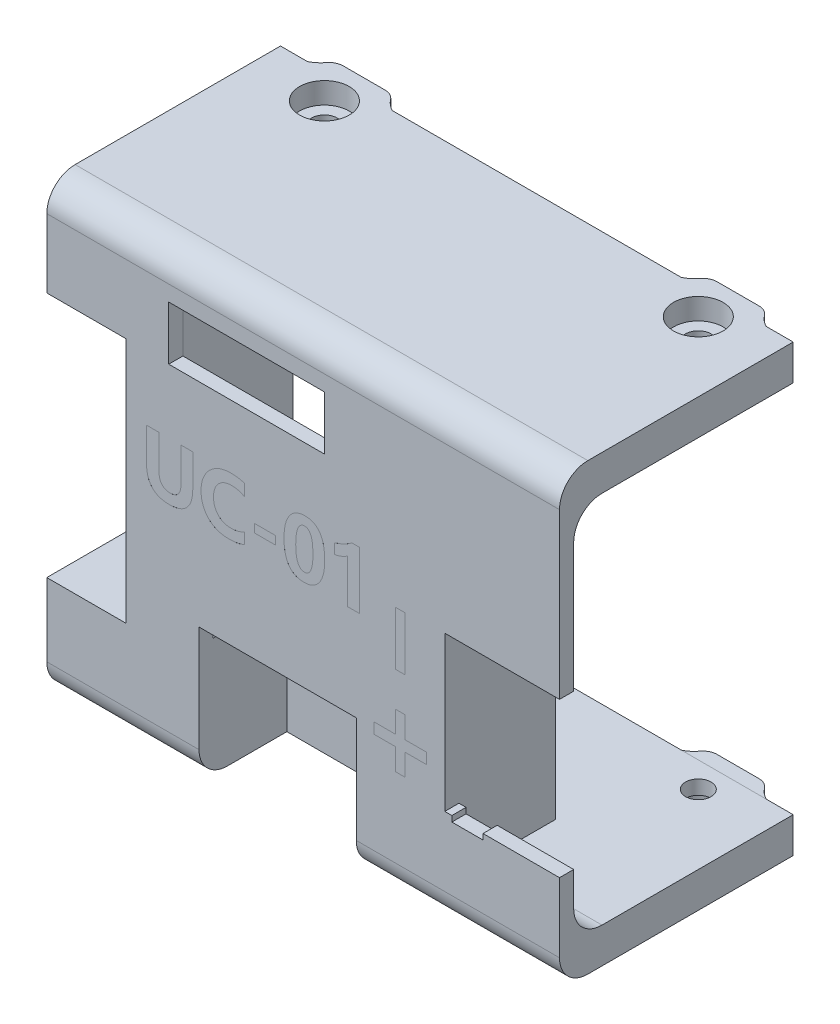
SolidWorks part; units mm, degrees
ref_plane "前视基准面" through (0, 0, 0) normal (0, 0, 1) x (1, 0, 0)
ref_plane "上视基准面" through (0, 0, 0) normal (0, 1, 0) x (1, 0, 0)
ref_plane "右视基准面" through (0, 0, 0) normal (1, 0, 0) x (0, 0, -1)
sketch "草图1" plane through (0, 0, 0) normal (0, 0, 1) x (1, 0, 0)
  line L0 (-17.8, 8.85) -> (-12.8, 8.85)
  line L2 (-12.8, 8.85) -> (-12.8, 0.35)
  line L3 (-12.8, 0.35) -> (-5.9, 0.35)
  line L4 (-5.9, 0.35) -> (-5.9, -6.45)
  line L5 (-5.9, -6.45) -> (-12.8, -6.45)
  line L6 (-12.8, -6.45) -> (-12.8, -8.55)
  line L7 (-12.8, -8.55) -> (-17.8, -8.55)
  line L8 (-17.8, -8.55) -> (-17.8, -14.2)
  line L9 (-17.8, -14.2) -> (17.8, -14.2)
  line L10 (17.8, -14.2) -> (17.8, -8.8)
  line L11 (17.8, -8.8) -> (12.4, -8.8)
  line L12 (9.7, -8.8) -> (9.7, 2.1)
  line L13 (9.7, 2.1) -> (17.8, 2.1)
  line L14 (17.8, 2.1) -> (17.8, 14.2013)
  line L15 (17.8, 14.2013) -> (-17.8, 14.2)
  line L16 (-17.8, 14.2) -> (-17.8, 8.85)
  line L31 (-9.7903, 12.6005) -> (1.2097, 12.6005)
  line L32 (-9.7903, 12.6005) -> (-9.7903, 8.8005)
  line L33 (-9.7903, 8.8005) -> (1.2097, 8.8005)
  line L34 (1.2097, 12.6005) -> (1.2097, 8.8005)
  line L35 (-6.35, -7.9) -> (2.25, -7.9) construction
  line L36 (-6.35, -7.9) -> (-6.35, -11.4) construction
  line L37 (-6.35, -11.4) -> (2.25, -11.4) construction
  line L38 (2.25, -7.9) -> (2.25, -11.4) construction
  line L42 (10.2, -8.8) -> (10.2, -9.2)
  line L43 (10.2, -9.2) -> (12.4, -9.2)
  line L44 (12.4, -9.2) -> (12.4, -8.8)
  line L45 (10.2, -8.8) -> (9.7, -8.8)
  point P0 (1.2097, 10.7005)
  dimension "D1" = 11
  dimension "D3" = 3.8
  dimension "D4" = 3.5
  dimension "D5" = 2.8
  dimension "D20" = 0.4
  dimension "D21" = 5.4
  dimension "D22" = 0.5
extrude "凸台-拉伸1" add sketch "草图1" against normal blind 1
sketch "草图2" plane through (0, 0, -1) normal (0, 0, -1) x (-1, 0, 0)
  line L0 (-17.8, -14.2) -> (-17.8, -8.8) construction
  line L1 (17.8, -14.2) -> (-17.8, -14.2)
  line L2 (17.8, -14.2) -> (17.8, -13.2)
  line L3 (17.8, -13.2) -> (-17.8, -13.2)
  line L4 (-17.8, -14.2) -> (-17.8, -13.2)
  line L6 (17.8, 13.2013) -> (-17.8, 13.2013)
  line L7 (17.8, 13.2013) -> (17.8, 14.2013)
  line L8 (17.8, 14.2013) -> (-17.8, 14.2013)
  line L9 (-17.8, 13.2013) -> (-17.8, 14.2013)
  line L12 (17.8, 14.2) -> (17.8, 8.85) construction
  dimension "D1" = 1
  dimension "D2" = 1
extrude "凸台-拉伸2" add sketch "草图2" along normal blind 15.5
fillet "圆角1" radius 2 2 edges at (0, -13.2, -1) (0, 13.2013, -1)
sketch "草图3" plane through (0, 14.2013, 0) normal (0, 1, 0) x (1, 0, 0)
  line L0 (-17.8, 16.5) -> (17.8, 16.5) construction
  line L3 (-13.5, 14.7) -> (12.9, 14.7) construction
  line L4 (-0.3, 14.7) -> (-0.3, 0) construction
  circle A1 centre (-13.5, 14.7) radius 0.9
  circle A3 centre (12.9, 14.7) radius 0.9
  dimension "D1" = 1.8
  dimension "D2" = 1.8
  dimension "D3" = 26.4
  dimension "D4" = 1.8
  dimension "D5" = 0.3
extrude "切除-拉伸1" cut sketch "草图3" against normal through all
sketch "草图4" plane through (17.8, 0, 0) normal (1, 0, 0) x (0, 0, -1)
  line L0 (2, 14.2013) -> (16.5, 14.2013)
  line L1 (0, 2.1) -> (0, -8.8)
  line L2 (1, 2.1) -> (1, -8.8)
  line L6 (0, -8.8) -> (0, -14.2)
  line L7 (0, -14.2) -> (16.5, -14.2)
  line L8 (16.5, -14.2) -> (16.5, -13.2)
  line L9 (16.5, -13.2) -> (3, -13.2)
  line L10 (1, -11.2) -> (1, -8.8)
  line L11 (1, -8.8) -> (0, -8.8)
  line L12 (0, -8.8) -> (0, -12.2)
  line L13 (2, -14.2) -> (16.5, -14.2)
  line L14 (16.5, -14.2) -> (16.5, -13.2)
  line L15 (16.5, -13.2) -> (3, -13.2)
  line L16 (1, -11.2) -> (1, -8.8)
  line L19 (0, 14.2013) -> (0, 2.1)
  line L20 (0, 2.1) -> (1, 2.1)
  line L21 (1, 2.1) -> (1, 11.2013)
  line L22 (3, 13.2013) -> (16.5, 13.2013)
  line L23 (16.5, 13.2013) -> (16.5, 14.2013)
  line L24 (16.5, 14.2013) -> (1, 14.2013)
  line L26 (0, 12.2013) -> (0, 2.1)
  line L28 (1, 2.1) -> (1, 11.2013)
  line L29 (3, 13.2013) -> (16.5, 13.2013)
  line L30 (16.5, 13.2013) -> (16.5, 14.2013)
  line L36 (1, 14.2013) -> (0, 14.2013)
  arc A0 (0, -12.2) -> (2, -14.2) centre (2, -12.2) ccw
  arc A1 (1, -11.2) -> (3, -13.2) centre (3, -11.2) ccw
  arc A2 (1, -11.2) -> (3, -13.2) centre (3, -11.2) ccw
  arc A3 (3, 13.2013) -> (1, 11.2013) centre (3, 11.2013) ccw
  arc A4 (3, 13.2013) -> (1, 11.2013) centre (3, 11.2013) ccw
  arc A5 (0, 12.2013) -> (2, 14.2013) centre (2, 12.2013) cw
  dimension "D3" = 2
  dimension "D1" = 0
  dimension "D2" = 0
extrude "切除-拉伸2" cut sketch "草图4" against normal through all flip side to cut
other "删除面1"
sketch "草图6" plane through (-17.8, 0, 0) normal (-1, 0, 0) x (0, 0, 1)
  line L0 (-16.5, 13.2013) -> (-3, 13.2013) construction
  line L1 (-16.5, -13.2) -> (-3, -13.2) construction
  line L2 (-1, -8.55) -> (-1, -11.2) construction
  line L3 (-1, 11.2013) -> (-1, 8.85) construction
  line L4 (-10.2, 13.2013) -> (-3, 13.2013)
  line L5 (-10.2, -13.2) -> (-3, -13.2)
  line L6 (-1, -8.55) -> (-1, -11.2)
  line L7 (-1, 11.2013) -> (-1, 8.85)
  line L8 (-1, 8.85) -> (-10.2, 8.85)
  line L9 (-10.2, 12.0027) -> (-10.2, -11.9987) construction
  line L10 (-10.2, 8.85) -> (-10.2, 13.2013)
  line L11 (-1, -8.55) -> (-10.2, -8.55)
  line L12 (-10.2, -8.55) -> (-10.2, -13.2)
  arc A0 (-3, -13.2) -> (-1, -11.2) centre (-3, -11.2) ccw construction
  arc A1 (-1, 11.2013) -> (-3, 13.2013) centre (-3, 11.2013) ccw construction
  arc A2 (-3, -13.2) -> (-1, -11.2) centre (-3, -11.2) ccw
  arc A3 (-1, 11.2013) -> (-3, 13.2013) centre (-3, 11.2013) ccw
extrude "凸台-拉伸3" add sketch "草图6" against normal blind 8
sketch "草图7" plane through (0, 0, -1) normal (0, 0, -1) x (-1, 0, 0)
  line L0 (9.8, 8.85) -> (12.8, 8.85) construction
  line L1 (12.8, 8.85) -> (9.8, 8.85)
  line L2 (12.8, 8.85) -> (12.8, 0.85)
  line L3 (12.8, 0.85) -> (9.8, 0.85)
  line L4 (9.8, 8.85) -> (9.8, 0.85)
  line L5 (12.8, -8.55) -> (9.8, -8.55)
  line L6 (12.8, -8.55) -> (12.8, -6.55)
  line L7 (12.8, -6.55) -> (9.8, -6.55)
  line L8 (9.8, -8.55) -> (9.8, -6.55)
  line L9 (9.8, -11.2) -> (9.8, -8.55) construction
  dimension "D1" = 8
  dimension "D2" = 2
extrude "凸台-拉伸4" add sketch "草图7" along normal blind 7.8
sketch "草图9" plane through (9.7, 0, 0) normal (1, 0, 0) x (0, 0, -1)
  line L1 (1, 11.2013) -> (1, -11.2)
  line L2 (3, -13.2) -> (8.8, -13.2)
  line L4 (8.8, -13.2) -> (8.8, 13.2013)
  line L5 (16.5, 13.2013) -> (3, 13.2013) construction
  line L6 (8.8, 13.2013) -> (3, 13.2013)
  line L7 (16.5, -13.2) -> (3, -13.2) construction
  arc A0 (3, 13.2013) -> (1, 11.2013) centre (3, 11.2013) ccw construction
  arc A1 (1, -11.2) -> (3, -13.2) centre (3, -11.2) ccw construction
  arc A2 (3, 13.2013) -> (1, 11.2013) centre (3, 11.2013) ccw
  arc A3 (1, -11.2) -> (3, -13.2) centre (3, -11.2) ccw
  dimension "D1" = 7.8
extrude "凸台-拉伸6" add sketch "草图9" against normal blind 6 contours L4 L6 A2 L1 A3 L2
other "移动面1" [suppressed] parameters "D1"=5
sketch "草图10" plane through (0, 0, 0) normal (0, 0, 1) x (1, 0, 0)
  line L0 (-12.8, 8.85) -> (-12.8, 10.85)
  line L2 (-12.8, 10.85) -> (-15.3, 10.85)
  line L3 (-15.3, 10.85) -> (-15.3, 8.85)
  line L4 (-17.8, 8.85) -> (-12.8, 8.85) construction
  dimension "D1" = 2.5
  dimension "D2" = 2
extrude "切除-拉伸3" cut sketch "草图10" against normal through all and the other way through all
sketch "草图11" plane through (0, 0, 0) normal (0, 0, 1) x (1, 0, 0)
  line L0 (-15.3, -8.55) -> (-15.3, -10.55)
  line L2 (-15.3, -10.55) -> (-12.8, -10.55)
  line L3 (-12.8, -10.55) -> (-12.8, -8.55)
  line L5 (-12.8, -8.55) -> (-17.8, -8.55) construction
  dimension "D1" = 2.5
  dimension "D2" = 2
extrude "切除-拉伸4" cut sketch "草图11" against normal through all and the other way through all
other "移动面2" parameters "D1"=0.6
other "移动面3" parameters "D1"=4.65
other "移动面5" parameters "D1"=4.35
sketch "草图13" plane through (0, 0, -8.8) normal (0, 0, -1) x (-1, 0, 0)
  line L0 (-3.7, -13.2) -> (-3.7, 13.2013) construction
  line L1 (-9.7, 13.2013) -> (-3.7, 13.2013)
  line L2 (-9.7, 13.2013) -> (-9.7, 0.0007)
  line L3 (-9.7, 0.0007) -> (-3.7, 0.0007)
  line L4 (-3.7, 13.2013) -> (-3.7, 0.0007)
extrude "切除-拉伸5" cut sketch "草图13" against normal blind 1
sketch "草图14" plane through (0, 0, 0) normal (0, 0, 1) x (1, 0, 0)
  line L0 (-12.8, 10.85) -> (-12.8, -10.55) construction
  line L1 (-15.3, 10.85) -> (-12.8, 10.85)
  line L2 (-15.3, 10.85) -> (-15.3, 8.85)
  line L3 (-15.3, 8.85) -> (-12.8, 8.85)
  line L4 (-12.8, 10.85) -> (-12.8, 8.85)
  line L6 (-15.3, -8.55) -> (-12.8, -8.55)
  line L7 (-15.3, -8.55) -> (-15.3, -10.55)
  line L8 (-15.3, -10.55) -> (-12.8, -10.55)
  line L9 (-12.8, -8.55) -> (-12.8, -10.55)
extrude "凸台-拉伸7" add sketch "草图14" against normal up to surface (8.8 mm away)
sketch "草图16" plane through (0, 0, 0) normal (0, 0, 1) x (1, 0, 0)
  line L0 (17.7, -11.9987) -> (-18.3, -11.9987) construction
  line L1 (-7.6499, -8.1987) -> (3.3501, -8.1987)
  line L2 (-7.6499, -8.1987) -> (-7.6499, -11.9987)
  line L3 (-7.6499, -11.9987) -> (3.3501, -11.9987)
  line L4 (3.3501, -8.1987) -> (3.3501, -11.9987)
  line L5 (-7.6499, -8.1987) -> (3.3501, -11.9987) construction
  line L6 (-7.6499, -11.9987) -> (3.3501, -8.1987) construction
  line L7 (-2.1499, -9.7947) -> (-2.1499, -10.3027) construction
  point P4 (-2.1499, -10.0987)
  dimension "D1" = 11
  dimension "D2" = 3.8
extrude "切除-拉伸7" cut sketch "草图16" against normal blind 10
sketch "草图17" plane through (0, -14.2, 0) normal (0, -1, 0) x (1, 0, 0)
  line L1 (-7.6499, 0) -> (3.3501, 0)
  line L2 (-7.6499, 0) -> (-7.6499, -6.2)
  line L3 (-7.6499, -6.2) -> (3.3501, -6.2)
  line L4 (3.3501, 0) -> (3.3501, -6.2)
  line L5 (-7.6499, 0) -> (3.3501, -6.2) construction
  line L6 (-7.6499, -6.2) -> (3.3501, 0) construction
  line L7 (3.3501, -1.1664) -> (3.3501, 0) construction
  line L8 (-18.4, 0) -> (17.8, 0) construction
  point P4 (-2.1499, -3.1)
  dimension "D1" = 6.2
extrude "切除-拉伸8" cut sketch "草图17" against normal up to surface (6.0013 mm away)
sketch "草图18" plane through (0, 0, -1) normal (0, 0, -1) x (-1, 0, 0)
  line L0 (-3.7, 11.2013) -> (-3.7, -11.2) construction
  line L1 (-3.7, -8.1987) -> (5.5675, -8.1987)
  line L2 (-3.7, -8.1987) -> (-3.7, -5.1987)
  line L3 (-3.7, -5.1987) -> (5.5675, -5.1987)
  line L4 (5.5675, -7.3751) -> (5.5675, -5.1987)
  line L5 (-3.7, -8.1987) -> (5.5675, -5.1987) construction
  line L6 (-3.7, -5.1987) -> (5.5675, -8.1987) construction
  line L8 (-3.3501, -8.1987) -> (7.6499, -8.1987) construction
  line L9 (5.5675, -7.3751) -> (9.8, -7.3751)
  line L10 (9.8, -7.3751) -> (9.8, -13.2)
  line L12 (9.8, -13.2) -> (7.6499, -13.2)
  line L13 (7.6499, -13.2) -> (7.6499, -8.1987)
  line L16 (7.6499, -8.1987) -> (5.5675, -8.1987)
  line L17 (9.8, -6.55) -> (9.8, -13.2) construction
  line L19 (9.8, -13.2) -> (7.6499, -13.2) construction
  point P4 (0.9337, -6.6987)
  dimension "D1" = 3
extrude "凸台-拉伸8" add sketch "草图18" along normal up to surface (7.8 mm away)
other "移动面6" parameters "D1"=0.25
sketch "草图20" plane through (0, -14.2, 0) normal (0, -1, 0) x (1, 0, 0)
  line L1 (-7.6499, -6.2) -> (3.7, -6.2)
  line L2 (-7.6499, -6.2) -> (-7.6499, -8.8)
  line L3 (-7.6499, -8.8) -> (3.7, -8.8)
  line L4 (3.7, -6.2) -> (3.7, -8.8)
  line L5 (-7.6499, -6.2) -> (3.7, -8.8) construction
  line L6 (-7.6499, -8.8) -> (3.7, -6.2) construction
  point P4 (-1.9749, -7.5)
extrude "凸台-拉伸9" add sketch "草图20" against normal blind 2.5
other "删除面2"
other "移动面8" parameters "D1"=1.5
sketch "草图21" plane through (0, -15.7, 0) normal (0, -1, 0) x (1, 0, 0)
  circle A0 centre (-13.5, -14.7) radius 1.75
  circle A1 centre (12.9, -14.7) radius 1.75
  dimension "D1" = 3.5
extrude "切除-拉伸9" cut sketch "草图21" against normal blind 1.5
sketch "草图22" plane through (0, 15.7013, 0) normal (0, 1, 0) x (1, 0, 0)
  circle A0 centre (-13.5, 14.7) radius 1.75
  circle A1 centre (12.9, 14.7) radius 1.75
  dimension "D1" = 3.5
extrude "切除-拉伸10" cut sketch "草图22" against normal blind 1.5
fillet "圆角2" radius 2 3 edges at (10.5751, -15.7, 0) (-0.3, 15.7013, 0) (-13.0249, -15.7, 0)
sketch "草图23" plane through (0, 0, 0) normal (0, 0, 1) x (1, 0, 0)
  line L0 (-12.8, 8.85) -> (-12.8, -8.55) construction
  text T0 "UC-01" font "微软雅黑" height 4
  dimension "D1" = 1
extrude "切除-拉伸11" cut sketch "草图23" against normal blind 0.2
sketch "草图24" plane through (0, 0, -0.2) normal (0, 0, 1) x (1, 0, 0)
  line L5 (-2.239, 1.5082) -> (-2.239, 2.0935) construction
  line L6 (-2.239, 2.0935) -> (-3.7512, 2.0935) construction
  line L7 (-3.7512, 2.0935) -> (-3.7512, 1.5082) construction
  line L8 (-3.7512, 1.5082) -> (-2.239, 1.5082) construction
  line L9 (-4.4341, 0.4495) -> (-4.4341, 1.2155) construction
  line L10 (-4.4341, 3.3618) -> (-4.4341, 4.185) construction
  line L11 (-8.0927, 2.0203) -> (-8.0927, 4.2886) construction
  line L12 (-8.0927, 4.2886) -> (-8.922, 4.2886) construction
  line L13 (-8.922, 4.2886) -> (-8.922, 1.9304) construction
  line L14 (-10.4829, 1.967) -> (-10.4829, 4.2886) construction
  line L15 (-10.4829, 4.2886) -> (-11.361, 4.2886) construction
  line L16 (-11.361, 4.2886) -> (-11.361, 1.9739) construction
  line L22 (-2.239, 1.5082) -> (-2.239, 2.0935)
  line L23 (-2.239, 2.0935) -> (-3.7512, 2.0935)
  line L24 (-3.7512, 2.0935) -> (-3.7512, 1.5082)
  line L25 (-3.7512, 1.5082) -> (-2.239, 1.5082)
  line L26 (-4.4341, 0.4495) -> (-4.4341, 1.2155)
  line L27 (-4.4341, 3.3618) -> (-4.4341, 4.185)
  line L28 (-8.0927, 2.0203) -> (-8.0927, 4.2886)
  line L29 (-8.0927, 4.2886) -> (-8.922, 4.2886)
  line L30 (-8.922, 4.2886) -> (-8.922, 1.9304)
  line L31 (-10.4829, 1.967) -> (-10.4829, 4.2886)
  line L32 (-10.4829, 4.2886) -> (-11.361, 4.2886)
  line L33 (-11.361, 4.2886) -> (-11.361, 1.9739)
  line L39 (3.6634, 4.3374) -> (3.1405, 4.3374)
  line L40 (1.9073, 3.733) -> (1.9073, 3.0203)
  line L41 (2.8341, 3.3931) -> (2.8341, 0.2886)
  line L42 (2.8341, 0.2886) -> (3.6634, 0.2886)
  line L43 (3.6634, 0.2886) -> (3.6634, 4.3374)
  line L44 (3.6634, 4.3374) -> (3.1405, 4.3374)
  line L45 (1.9073, 3.733) -> (1.9073, 3.0203)
  line L46 (2.8341, 3.3931) -> (2.8341, 0.2886)
  line L47 (2.8341, 0.2886) -> (3.6634, 0.2886)
  line L48 (3.6634, 0.2886) -> (3.6634, 4.3374)
  spline S3 degree 3 poles (447.3482, -890.9115) (-3.7031, 15.2341) (-1.3723, 2.5269) (-4.6578, 1.1076) (-4.7746, 1.0655) (-4.8945, 1.0311) (-5.0173, 1.0045) (-5.143, 0.9854) (-8.9746, 0.6371) (-13.3163, 12.608) (28.2486, -998.4467) knots -10.258138 -10.258138 -10.258138 -10.258138 0.123289 0.246059 0.368848 0.492193 0.616624 0.741912 0.870046 12.042592 12.042592 12.042592 12.042592 only from (-4.4341, 1.2155) to (-5.4021, 0.9716) construction
  spline S4 degree 3 poles (-58.3829, -997.62) (2.0899, 14.5382) (-2.224, 0.5394) (-5.6685, 0.9915) (-5.7921, 1.0193) (-5.9084, 1.0588) (-6.0178, 1.1077) (-6.1193, 1.1696) (-6.2134, 1.2425) (-6.3001, 1.3254) (-6.3779, 1.4176) (-6.4452, 1.5179) (-6.502, 1.6255) (-6.5482, 1.74) (-6.5853, 1.8613) (-6.6108, 1.9897) (-7.0383, 5.7463) (6.2612, 10.2353) (-1005.5774, -43.2789) knots -4.971116 -4.971116 -4.971116 -4.971116 0.068212 0.133499 0.196423 0.256776 0.316257 0.374705 0.433557 0.493283 0.55321 0.612969 0.672933 0.734251 0.796781 0.861688 0.929139 6.423769 6.423769 6.423769 6.423769 only from (-5.4021, 0.9716) to (-6.6293, 2.2658) construction
  spline S5 degree 3 poles (-1005.0194, 58.9049) (7.2315, -5.5986) (-7.0712, -1.0508) (-6.6088, 2.5493) (-6.5834, 2.6819) (-6.5435, 2.8065) (-6.4952, 2.925) (-6.4344, 3.0358) (-6.3634, 3.14) (-6.2818, 3.2359) (-6.1914, 3.3228) (-6.0925, 3.3987) (-5.9863, 3.4631) (-5.8724, 3.5148) (-5.7519, 3.5567) (-5.6235, 3.5852) (-1.9471, 4.0411) (2.5575, -9.464) (-57.0147, 1002.2588) knots -5.005182 -5.005182 -5.005182 -5.005182 0.070115 0.137017 0.20143 0.263758 0.324619 0.384879 0.445005 0.50533 0.565469 0.624812 0.684081 0.74352 0.80411 0.866968 0.932059 6.116477 6.116477 6.116477 6.116477 only from (-6.6293, 2.2658) to (-5.348, 3.6057) construction
  spline S6 degree 3 poles (31.8274, 1002.913) (-12.9494, -8.1188) (-8.7481, 3.9419) (-5.1001, 3.5918) (-4.9804, 3.5729) (-4.8642, 3.5463) (-4.7515, 3.5116) (-4.6419, 3.4698) (-1.6184, 2.0699) (-4.6337, -10.5677) (474.6811, 881.1006) knots -11.08115 -11.08115 -11.08115 -11.08115 0.131365 0.260042 0.386555 0.51068 0.633019 0.755687 0.877798 11.054687 11.054687 11.054687 11.054687 only from (-5.348, 3.6057) to (-4.4341, 3.3618) construction
  spline S7 degree 3 poles (327.0674, 947.639) (-1.7117, -8.2725) (-1.351, 3.2979) (-4.6427, 4.2535) (-4.7555, 4.2791) (-4.8743, 4.3006) (-4.9989, 4.317) (-5.1293, 4.3294) (-10.0457, 4.5726) (-15.1405, -5.5057) (1.7412, 1004.308) knots -10.047872 -10.047872 -10.047872 -10.047872 0.107963 0.220366 0.337373 0.458737 0.586233 0.718567 0.855895 15.509195 15.509195 15.509195 15.509195 only from (-4.4341, 4.185) to (-5.4059, 4.3374) construction
  spline S8 degree 3 poles (-57.6899, 1002.9688) (4.8826, -11.7097) (-1.0209, 4.9509) (-5.8467, 4.3035) (-6.0532, 4.2577) (-6.2486, 4.1914) (-6.4341, 4.1079) (-6.608, 4.0037) (-6.7721, 3.8824) (-6.9228, 3.7421) (-7.0597, 3.5879) (-7.1799, 3.4223) (-7.2815, 3.2455) (-7.3636, 3.0577) (-7.4291, 2.8596) (-7.4742, 2.6503) (-8.1108, -2.3067) (8.3132, -8.2822) (-1006.272, 51.6656) knots -4.141639 -4.141639 -4.141639 -4.141639 0.067389 0.13232 0.194855 0.255866 0.316133 0.376011 0.436454 0.4979 0.55941 0.620133 0.680255 0.740957 0.802757 0.866128 0.931705 5.254621 5.254621 5.254621 5.254621 only from (-5.4059, 4.3374) to (-7.5073, 2.204) construction
  spline S9 degree 3 poles (-1006.6116, -40.0715) (7.5102, 12.5009) (-8.0628, 6.7177) (-7.478, 1.7826) (-7.4368, 1.5864) (-7.3799, 1.4011) (-7.3058, 1.227) (-7.2143, 1.0645) (-7.1073, 0.9129) (-6.9845, 0.7733) (-6.8475, 0.6478) (-6.6982, 0.5376) (-6.5361, 0.4464) (-6.3636, 0.3701) (-6.1792, 0.3118) (-5.9834, 0.2699) (-1.1365, -0.3279) (4.6206, 15.6065) (-50.5508, -998.7248) knots -4.566138 -4.566138 -4.566138 -4.566138 0.069616 0.136223 0.200084 0.261924 0.322179 0.381519 0.440709 0.500203 0.559804 0.618828 0.678076 0.738077 0.799831 0.863504 0.93014 5.483125 5.483125 5.483125 5.483125 only from (-7.5073, 2.204) to (-5.5614, 0.2399) construction
  spline S10 degree 3 poles (8.5748, -999.6594) (-15.6172, 11.7428) (-10.2761, -0.0632) (-5.2329, 0.2514) (-5.0795, 0.2681) (-4.9342, 0.2908) (-4.7968, 0.3193) (-4.6682, 0.3563) (-1.3965, 1.4907) (-3.0171, 14.5127) (382.1615, -921.7816) knots -12.687678 -12.687678 -12.687678 -12.687678 0.147062 0.286452 0.419776 0.547259 0.667915 0.783756 0.894285 9.644628 9.644628 9.644628 9.644628 only from (-5.5614, 0.2399) to (-4.4341, 0.4495) construction
  spline S11 degree 3 poles (990.6881, -25.9645) (-19.9383, 9.2654) (-8.6331, 5.2812) (-8.9327, 1.7077) (-8.948, 1.6064) (-8.9681, 1.5124) (-8.9957, 1.426) (-9.029, 1.3468) (-9.0678, 1.2747) (-9.1142, 1.2114) (-9.1652, 1.154) (-9.2236, 1.1054) (-9.2874, 1.0636) (-9.3578, 1.03) (-9.4338, 1.0031) (-9.5163, 0.9855) (-12.1393, 0.629) (-15.6353, 13.0838) (52.8097, -997.0511) knots -7.393918 -7.393918 -7.393918 -7.393918 0.082236 0.159849 0.232589 0.300169 0.36431 0.425385 0.48275 0.53814 0.59213 0.645867 0.699421 0.754089 0.81139 0.870698 0.933422 6.436963 6.436963 6.436963 6.436963 only from (-8.922, 1.9304) to (-9.6963, 0.9716) construction
  spline S12 degree 3 poles (-60.1304, -997.7553) (-3.708, 12.7839) (-7.145, 0.6379) (-9.8796, 0.985) (-9.9629, 1.0047) (-10.0401, 1.0324) (-10.1113, 1.0675) (-10.1766, 1.1102) (-10.2353, 1.1615) (-10.2878, 1.2201) (-10.334, 1.2868) (-10.3745, 1.3608) (-10.408, 1.4432) (-10.4348, 1.5332) (-10.4575, 1.6306) (-10.472, 1.7359) (-10.7759, 5.396) (0.7037, 9.5294) (-1009.9473, -30.5076) knots -5.506458 -5.506458 -5.506458 -5.506458 0.065783 0.127811 0.186736 0.242624 0.297183 0.350708 0.403639 0.458007 0.513148 0.571273 0.63211 0.696983 0.765484 0.838809 0.91689 8.36214 8.36214 8.36214 8.36214 only from (-9.6963, 0.9716) to (-10.4829, 1.967) construction
  spline S13 degree 3 poles (-1010.7633, -32.5066) (2.9776, 12.2638) (-11.8358, 6.5734) (-11.3384, 1.5713) (-11.308, 1.3876) (-11.2636, 1.2175) (-11.2077, 1.0608) (-11.1387, 0.9175) (-11.0571, 0.7877) (-10.9617, 0.6719) (-10.8547, 0.5689) (-10.7342, 0.4806) (-10.6017, 0.4057) (-10.4564, 0.3445) (-10.2986, 0.2975) (-10.1283, 0.2645) (-5.5741, -0.2614) (-0.1904, 14.8104) (-53.3661, -998.8082) knots -5.339301 -5.339301 -5.339301 -5.339301 0.077366 0.150259 0.218727 0.283252 0.344541 0.402648 0.458898 0.513844 0.568341 0.622841 0.678755 0.736469 0.796966 0.860609 0.928246 5.863965 5.863965 5.863965 5.863965 only from (-11.361, 1.9739) to (-9.755, 0.2399) construction
  spline S14 degree 3 poles (36.0873, -998.707) (-19.4521, 15.2136) (-13.9656, -0.2759) (-9.3688, 0.2654) (-9.1925, 0.2986) (-9.0294, 0.3477) (-8.8786, 0.4099) (-8.7416, 0.4875) (-8.6166, 0.5778) (-8.5056, 0.6832) (-8.4069, 0.8021) (-8.3235, 0.936) (-8.2512, 1.0826) (-8.1926, 1.2434) (-8.1483, 1.4185) (-8.1155, 1.6067) (-7.6201, 6.9397) (-21.8649, 12.842) (991.5286, -25.4517) knots -4.759628 -4.759628 -4.759628 -4.759628 0.072067 0.139886 0.203826 0.264504 0.322468 0.378541 0.43322 0.487644 0.542487 0.598649 0.656728 0.71775 0.782003 0.850404 0.922752 6.526676 6.526676 6.526676 6.526676 only from (-9.755, 0.2399) to (-8.0927, 2.0203) construction
  spline S17 degree 3 poles (1177.1826, -1614.7304) (2.6721, 26.1054) (8.1484, 7.6131) (2.8687, 4.1488) (2.7228, 4.0656) (2.5716, 3.9868) (2.4147, 3.9133) (2.251, 3.8475) (-3.9719, 1.5791) (-16.3139, 18.0778) (609.1367, -1901.742) knots -13.347297 -13.347297 -13.347297 -13.347297 0.11901 0.23902 0.360663 0.483838 0.609267 0.736759 0.866991 14.991437 14.991437 14.991437 14.991437 only from (3.1405, 4.3374) to (1.9073, 3.733)
  spline S18 degree 3 poles (-4.4341, 1.2155) (-4.4707, 1.1959) (-4.5437, 1.1568) (-4.6578, 1.1076) (-4.7746, 1.0655) (-4.8945, 1.0311) (-5.0173, 1.0045) (-5.143, 0.9854) (-5.2716, 0.9737) (-5.3584, 0.9723) (-5.4021, 0.9716) knots 0 0 0 0 0.123289 0.246059 0.368848 0.492193 0.616624 0.741912 0.870046 1 1 1 1
  spline S19 degree 3 poles (-5.4021, 0.9716) (-5.4479, 0.9725) (-5.5375, 0.9743) (-5.6685, 0.9915) (-5.7921, 1.0193) (-5.9084, 1.0588) (-6.0178, 1.1077) (-6.1193, 1.1696) (-6.2134, 1.2425) (-6.3001, 1.3254) (-6.3779, 1.4176) (-6.4452, 1.5179) (-6.502, 1.6255) (-6.5482, 1.74) (-6.5853, 1.8613) (-6.6108, 1.9897) (-6.6262, 2.1254) (-6.6282, 2.2182) (-6.6293, 2.2658) knots 0 0 0 0 0.068212 0.133499 0.196423 0.256776 0.316257 0.374705 0.433557 0.493283 0.55321 0.612969 0.672933 0.734251 0.796781 0.861688 0.929139 1 1 1 1
  spline S20 degree 3 poles (-6.6293, 2.2658) (-6.6284, 2.3146) (-6.6267, 2.4101) (-6.6088, 2.5493) (-6.5834, 2.6819) (-6.5435, 2.8065) (-6.4952, 2.925) (-6.4344, 3.0358) (-6.3634, 3.14) (-6.2818, 3.2359) (-6.1914, 3.3228) (-6.0925, 3.3987) (-5.9863, 3.4631) (-5.8724, 3.5148) (-5.7519, 3.5567) (-5.6235, 3.5852) (-5.4879, 3.602) (-5.3953, 3.6045) (-5.348, 3.6057) knots 0 0 0 0 0.070115 0.137017 0.20143 0.263758 0.324619 0.384879 0.445005 0.50533 0.565469 0.624812 0.684081 0.74352 0.80411 0.866968 0.932059 1 1 1 1
  spline S21 degree 3 poles (-5.348, 3.6057) (-5.3061, 3.605) (-5.223, 3.6036) (-5.1001, 3.5918) (-4.9804, 3.5729) (-4.8642, 3.5463) (-4.7515, 3.5116) (-4.6419, 3.4698) (-4.5354, 3.4205) (-4.4679, 3.3814) (-4.4341, 3.3618) knots 0 0 0 0 0.131365 0.260042 0.386555 0.51068 0.633019 0.755687 0.877798 1 1 1 1
  spline S22 degree 3 poles (-4.4341, 4.185) (-4.4675, 4.1973) (-4.5357, 4.2225) (-4.6427, 4.2535) (-4.7555, 4.2791) (-4.8743, 4.3006) (-4.9989, 4.317) (-5.1293, 4.3294) (-5.2656, 4.3361) (-5.3584, 4.337) (-5.4059, 4.3374) knots 0 0 0 0 0.107963 0.220366 0.337373 0.458737 0.586233 0.718567 0.855895 1 1 1 1
  spline S23 degree 3 poles (-5.4059, 4.3374) (-5.4815, 4.3358) (-5.6298, 4.3326) (-5.8467, 4.3035) (-6.0532, 4.2577) (-6.2486, 4.1914) (-6.4341, 4.1079) (-6.608, 4.0037) (-6.7721, 3.8824) (-6.9228, 3.7421) (-7.0597, 3.5879) (-7.1799, 3.4223) (-7.2815, 3.2455) (-7.3636, 3.0577) (-7.4291, 2.8596) (-7.4742, 2.6503) (-7.5024, 2.4307) (-7.5056, 2.2806) (-7.5073, 2.204) knots 0 0 0 0 0.067389 0.13232 0.194855 0.255866 0.316133 0.376011 0.436454 0.4979 0.55941 0.620133 0.680255 0.740957 0.802757 0.866128 0.931705 1 1 1 1
  spline S24 degree 3 poles (-7.5073, 2.204) (-7.5057, 2.1316) (-7.5025, 1.9897) (-7.478, 1.7826) (-7.4368, 1.5864) (-7.3799, 1.4011) (-7.3058, 1.227) (-7.2143, 1.0645) (-7.1073, 0.9129) (-6.9845, 0.7733) (-6.8475, 0.6478) (-6.6982, 0.5376) (-6.5361, 0.4464) (-6.3636, 0.3701) (-6.1792, 0.3118) (-5.9834, 0.2699) (-5.7763, 0.2444) (-5.6342, 0.2414) (-5.5614, 0.2399) knots 0 0 0 0 0.069616 0.136223 0.200084 0.261924 0.322179 0.381519 0.440709 0.500203 0.559804 0.618828 0.678076 0.738077 0.799831 0.863504 0.93014 1 1 1 1
  spline S25 degree 3 poles (-5.5614, 0.2399) (-5.5048, 0.2404) (-5.3944, 0.2413) (-5.2329, 0.2514) (-5.0795, 0.2681) (-4.9342, 0.2908) (-4.7968, 0.3193) (-4.6682, 0.3563) (-4.5472, 0.3982) (-4.4713, 0.4326) (-4.4341, 0.4495) knots 0 0 0 0 0.147062 0.286452 0.419776 0.547259 0.667915 0.783756 0.894285 1 1 1 1
  spline S26 degree 3 poles (-8.922, 1.9304) (-8.9225, 1.8918) (-8.9236, 1.8167) (-8.9327, 1.7077) (-8.948, 1.6064) (-8.9681, 1.5124) (-8.9957, 1.426) (-9.029, 1.3468) (-9.0678, 1.2747) (-9.1142, 1.2114) (-9.1652, 1.154) (-9.2236, 1.1054) (-9.2874, 1.0636) (-9.3578, 1.03) (-9.4338, 1.0031) (-9.5163, 0.9855) (-9.6043, 0.9735) (-9.665, 0.9722) (-9.6963, 0.9716) knots 0 0 0 0 0.082236 0.159849 0.232589 0.300169 0.36431 0.425385 0.48275 0.53814 0.59213 0.645867 0.699421 0.754089 0.81139 0.870698 0.933422 1 1 1 1
  spline S27 degree 3 poles (-9.6963, 0.9716) (-9.7281, 0.9723) (-9.7899, 0.9736) (-9.8796, 0.985) (-9.9629, 1.0047) (-10.0401, 1.0324) (-10.1113, 1.0675) (-10.1766, 1.1102) (-10.2353, 1.1615) (-10.2878, 1.2201) (-10.334, 1.2868) (-10.3745, 1.3608) (-10.408, 1.4432) (-10.4348, 1.5332) (-10.4575, 1.6306) (-10.472, 1.7359) (-10.4813, 1.8489) (-10.4824, 1.9268) (-10.4829, 1.967) knots 0 0 0 0 0.065783 0.127811 0.186736 0.242624 0.297183 0.350708 0.403639 0.458007 0.513148 0.571273 0.63211 0.696983 0.765484 0.838809 0.91689 1 1 1 1
  spline S28 degree 3 poles (-11.361, 1.9739) (-11.36, 1.9039) (-11.358, 1.7681) (-11.3384, 1.5713) (-11.308, 1.3876) (-11.2636, 1.2175) (-11.2077, 1.0608) (-11.1387, 0.9175) (-11.0571, 0.7877) (-10.9617, 0.6719) (-10.8547, 0.5689) (-10.7342, 0.4806) (-10.6017, 0.4057) (-10.4564, 0.3445) (-10.2986, 0.2975) (-10.1283, 0.2645) (-9.9459, 0.2434) (-9.8199, 0.2411) (-9.755, 0.2399) knots 0 0 0 0 0.077366 0.150259 0.218727 0.283252 0.344541 0.402648 0.458898 0.513844 0.568341 0.622841 0.678755 0.736469 0.796966 0.860609 0.928246 1 1 1 1
  spline S29 degree 3 poles (-9.755, 0.2399) (-9.6879, 0.241) (-9.5576, 0.2432) (-9.3688, 0.2654) (-9.1925, 0.2986) (-9.0294, 0.3477) (-8.8786, 0.4099) (-8.7416, 0.4875) (-8.6166, 0.5778) (-8.5056, 0.6832) (-8.4069, 0.8021) (-8.3235, 0.936) (-8.2512, 1.0826) (-8.1926, 1.2434) (-8.1483, 1.4185) (-8.1155, 1.6067) (-8.0967, 1.8091) (-8.0941, 1.9484) (-8.0927, 2.0203) knots 0 0 0 0 0.072067 0.139886 0.203826 0.264504 0.322468 0.378541 0.43322 0.487644 0.542487 0.598649 0.656728 0.71775 0.782003 0.850404 0.922752 1 1 1 1
  spline S30 degree 3 poles (345.0808, -1967.2626) (-9.5696, 20.842) (-1.9523, 2.0887) (2.1487, 3.0663) (2.2762, 3.1046) (2.4059, 3.1518) (2.5319, 3.2047) (2.6463, 3.2635) (5.7336, 5.1244) (-3.6058, 24.4526) (1167.4311, -1622.4991) knots -12.13168 -12.13168 -12.13168 -12.13168 0.116848 0.240752 0.372278 0.511899 0.650498 0.777711 0.893917 11.331892 11.331892 11.331892 11.331892 only from (1.9073, 3.0203) to (2.8341, 3.3931)
  spline S31 degree 3 poles (-2000.7953, -52.1675) (20.3133, 17.4544) (-2.2049, 9.205) (-1.6338, 1.7642) (-1.6073, 1.5543) (-1.5683, 1.36) (-1.5194, 1.1808) (-1.4585, 1.0172) (-1.3869, 0.8688) (-1.3036, 0.7358) (-1.2088, 0.6187) (-1.1034, 0.5164) (-0.986, 0.4306) (-0.8575, 0.3609) (-0.7182, 0.3064) (-0.5679, 0.268) (4.1878, -0.4515) (10.7859, 24.6644) (-132.5936, -1995.2913) knots -7.822298 -7.822298 -7.822298 -7.822298 0.086578 0.167865 0.244075 0.315263 0.381998 0.444776 0.503765 0.559952 0.614067 0.666344 0.718446 0.770706 0.824131 0.879782 0.938113 6.012932 6.012932 6.012932 6.012932 only from (-1.6537, 2.2246) to (-0.2383, 0.2399)
  spline S32 degree 3 poles (131.3302, -1995.3425) (-11.311, 24.5676) (-4.6938, -0.4727) (0.0946, 0.2697) (0.2471, 0.3126) (0.389, 0.3726) (0.5215, 0.4479) (0.6423, 0.5425) (0.7522, 0.6537) (0.8517, 0.7812) (0.9398, 0.9239) (1.0161, 1.0814) (1.0808, 1.2529) (1.1339, 1.4385) (1.1749, 1.6383) (1.2031, 1.852) (1.7947, 9.3898) (-20.544, 17.7602) (2000.3662, -54.5295) knots -4.876629 -4.876629 -4.876629 -4.876629 0.060073 0.117299 0.171929 0.225233 0.277923 0.330711 0.384967 0.440945 0.49937 0.559927 0.623536 0.690675 0.761437 0.836458 0.915811 8.657474 8.657474 8.657474 8.657474 only from (-0.2383, 0.2399) to (1.2244, 2.3168)
  spline S33 degree 3 poles (2000.6666, 45.3728) (-19.918, -13.603) (1.7529, -5.0777) (1.2056, 2.7857) (1.1786, 2.9993) (1.1404, 3.197) (1.0935, 3.3796) (1.0327, 3.5455) (0.9632, 3.6966) (0.882, 3.8321) (0.7898, 3.9518) (0.6857, 4.055) (0.5715, 4.1428) (0.4457, 4.2142) (0.3094, 4.2699) (0.1622, 4.3095) (-4.5314, 5.0226) (-11.0019, -19.8525) (128.6121, 2000.1168) knots -8.247954 -8.247954 -8.247954 -8.247954 0.087973 0.170373 0.247723 0.319998 0.387454 0.450729 0.510302 0.566596 0.620689 0.672807 0.72421 0.775629 0.828343 0.88258 0.939659 5.933718 5.933718 5.933718 5.933718 only from (1.2244, 2.3168) to (-0.1605, 4.3374)
  spline S34 degree 3 poles (-129.3875, 2000.0838) (11.0603, -20.0947) (4.3758, 5.052) (-0.5004, 4.3075) (-0.6563, 4.2648) (-0.8016, 4.2051) (-0.9361, 4.1282) (-1.06, 4.0344) (-1.1725, 3.9228) (-1.2741, 3.7948) (-1.3639, 3.6509) (-1.4418, 3.4917) (-1.5081, 3.3177) (-1.561, 3.128) (-1.6024, 2.9237) (-1.633, 2.7041) (-2.2112, -5.2487) (19.609, -13.8563) (-2001.1154, 44.0574) knots -4.866609 -4.866609 -4.866609 -4.866609 0.060191 0.117319 0.172128 0.225344 0.277803 0.330379 0.38412 0.439685 0.497456 0.557518 0.621033 0.687852 0.759059 0.834479 0.914866 8.921272 8.921272 8.921272 8.921272 only from (-0.1605, 4.3374) to (-1.6537, 2.2246)
  spline S35 degree 3 poles (-1.6537, 2.2246) (-1.6528, 2.1445) (-1.6511, 1.9893) (-1.6338, 1.7642) (-1.6073, 1.5543) (-1.5683, 1.36) (-1.5194, 1.1808) (-1.4585, 1.0172) (-1.3869, 0.8688) (-1.3036, 0.7358) (-1.2088, 0.6187) (-1.1034, 0.5164) (-0.986, 0.4306) (-0.8575, 0.3609) (-0.7182, 0.3064) (-0.5679, 0.268) (-0.4067, 0.2437) (-0.2955, 0.2411) (-0.2383, 0.2399) knots 0 0 0 0 0.086578 0.167865 0.244075 0.315263 0.381998 0.444776 0.503765 0.559952 0.614067 0.666344 0.718446 0.770706 0.824131 0.879782 0.938113 1 1 1 1
  spline S36 degree 3 poles (-0.2383, 0.2399) (-0.1808, 0.2414) (-0.0685, 0.2444) (0.0946, 0.2697) (0.2471, 0.3126) (0.389, 0.3726) (0.5215, 0.4479) (0.6423, 0.5425) (0.7522, 0.6537) (0.8517, 0.7812) (0.9398, 0.9239) (1.0161, 1.0814) (1.0808, 1.2529) (1.1339, 1.4385) (1.1749, 1.6383) (1.2031, 1.852) (1.221, 2.0797) (1.2232, 2.2363) (1.2244, 2.3168) knots 0 0 0 0 0.060073 0.117299 0.171929 0.225233 0.277923 0.330711 0.384967 0.440945 0.49937 0.559927 0.623536 0.690675 0.761437 0.836458 0.915811 1 1 1 1
  spline S37 degree 3 poles (1.2244, 2.3168) (1.2234, 2.3984) (1.2215, 2.5564) (1.2056, 2.7857) (1.1786, 2.9993) (1.1404, 3.197) (1.0935, 3.3796) (1.0327, 3.5455) (0.9632, 3.6966) (0.882, 3.8321) (0.7898, 3.9518) (0.6857, 4.055) (0.5715, 4.1428) (0.4457, 4.2142) (0.3094, 4.2699) (0.1622, 4.3095) (0.0044, 4.3335) (-0.1045, 4.3361) (-0.1605, 4.3374) knots 0 0 0 0 0.087973 0.170373 0.247723 0.319998 0.387454 0.450729 0.510302 0.566596 0.620689 0.672807 0.72421 0.775629 0.828343 0.88258 0.939659 1 1 1 1
  spline S38 degree 3 poles (-0.1605, 4.3374) (-0.2193, 4.3359) (-0.3339, 4.3329) (-0.5004, 4.3075) (-0.6563, 4.2648) (-0.8016, 4.2051) (-0.9361, 4.1282) (-1.06, 4.0344) (-1.1725, 3.9228) (-1.2741, 3.7948) (-1.3639, 3.6509) (-1.4418, 3.4917) (-1.5081, 3.3177) (-1.561, 3.128) (-1.6024, 2.9237) (-1.633, 2.7041) (-1.6501, 2.4693) (-1.6525, 2.3077) (-1.6537, 2.2246) knots 0 0 0 0 0.060191 0.117319 0.172128 0.225344 0.277803 0.330379 0.38412 0.439685 0.497456 0.557518 0.621033 0.687852 0.759059 0.834479 0.914866 1 1 1 1
  spline S39 degree 3 poles (2000.2434, 23.277) (-15.6656, -12.1454) (0.6979, -4.6142) (0.387, 2.615) (0.3759, 2.7645) (0.3599, 2.9028) (0.3399, 3.0305) (0.3138, 3.1469) (0.2846, 3.2525) (0.2503, 3.3468) (0.2117, 3.4307) (0.1679, 3.5032) (0.119, 3.5645) (0.0665, 3.6159) (0.008, 3.6551) (-0.0552, 3.6831) (-2.2508, 4.2483) (-7.175, -17.6966) (235.9332, 1989.5484) knots -12.611783 -12.611783 -12.611783 -12.611783 0.10193 0.197596 0.286641 0.369181 0.445811 0.516808 0.581768 0.641097 0.695609 0.746029 0.7918 0.835052 0.876512 0.916664 0.957753 4.88891 4.88891 4.88891 4.88891 only from (0.3951, 2.2864) to (-0.1933, 3.7033)
  spline S40 degree 3 poles (-243.0952, 1988.8684) (7.1287, -18.4733) (1.9384, 4.2687) (-0.3412, 3.6822) (-0.4091, 3.6541) (-0.471, 3.6126) (-0.5289, 3.5611) (-0.5809, 3.4976) (-0.6273, 3.4228) (-0.6691, 3.3369) (-0.7063, 3.2397) (-0.7381, 3.1311) (-0.7644, 3.0111) (-0.7862, 2.8798) (-0.8038, 2.7371) (-0.8154, 2.5833) (-1.153, -4.3505) (16.4997, -11.6721) (-2000.5366, 30.7432) knots -3.886049 -3.886049 -3.886049 -3.886049 0.043706 0.085899 0.127119 0.169323 0.21317 0.259615 0.309575 0.363977 0.423327 0.487889 0.558021 0.634071 0.716217 0.804564 0.89884 12.626563 12.626563 12.626563 12.626563 only from (-0.1933, 3.7033) to (-0.8244, 2.2452)
  spline S41 degree 3 poles (-2000.4391, -32.678) (16.6502, 15.289) (-1.1572, 8.3878) (-0.8153, 1.9272) (-0.8045, 1.7825) (-0.788, 1.6484) (-0.7657, 1.5251) (-0.7402, 1.4122) (-0.7096, 1.31) (-0.6723, 1.2189) (-0.6329, 1.1374) (-0.5867, 1.0674) (-0.5361, 1.0077) (-0.4804, 0.9583) (-0.4193, 0.9204) (-0.3536, 0.8935) (1.9923, 0.3402) (6.8365, 22.0536) (-218.3495, -1987.1392) knots -11.419951 -11.419951 -11.419951 -11.419951 0.100208 0.194085 0.281228 0.362752 0.438396 0.507745 0.572154 0.631131 0.685603 0.735702 0.782315 0.826937 0.869665 0.911916 0.954842 5.20304 5.20304 5.20304 5.20304 only from (-0.8244, 2.2452) to (-0.2093, 0.874)
  spline S42 degree 3 poles (232.1001, -1985.5075) (-7.2773, 22.4412) (-2.3191, 0.3267) (-0.0674, 0.8942) (-0.0027, 0.9221) (0.057, 0.9614) (0.1119, 1.0119) (0.1613, 1.0737) (0.2063, 1.1459) (0.2468, 1.2288) (0.2815, 1.3232) (0.3114, 1.4286) (0.3386, 1.5444) (0.3582, 1.6717) (0.3752, 1.8097) (0.3872, 1.9589) (0.6924, 9.2788) (-15.3838, 16.8632) (2000.22, -14.6172) knots -3.970386 -3.970386 -3.970386 -3.970386 0.043445 0.085263 0.126098 0.168161 0.211609 0.258133 0.308226 0.362525 0.421797 0.486648 0.55705 0.632959 0.715256 0.804016 0.898887 13.727447 13.727447 13.727447 13.727447 only from (-0.2093, 0.874) to (0.3951, 2.2864)
  spline S43 degree 3 poles (0.3951, 2.2864) (0.3947, 2.3435) (0.3939, 2.4544) (0.387, 2.615) (0.3759, 2.7645) (0.3599, 2.9028) (0.3399, 3.0305) (0.3138, 3.1469) (0.2846, 3.2525) (0.2503, 3.3468) (0.2117, 3.4307) (0.1679, 3.5032) (0.119, 3.5645) (0.0665, 3.6159) (0.008, 3.6551) (-0.0552, 3.6831) (-0.1227, 3.7005) (-0.1696, 3.7023) (-0.1933, 3.7033) knots 0 0 0 0 0.10193 0.197596 0.286641 0.369181 0.445811 0.516808 0.581768 0.641097 0.695609 0.746029 0.7918 0.835052 0.876512 0.916664 0.957753 1 1 1 1
  spline S44 degree 3 poles (-0.1933, 3.7033) (-0.2188, 3.7024) (-0.269, 3.7008) (-0.3412, 3.6822) (-0.4091, 3.6541) (-0.471, 3.6126) (-0.5289, 3.5611) (-0.5809, 3.4976) (-0.6273, 3.4228) (-0.6691, 3.3369) (-0.7063, 3.2397) (-0.7381, 3.1311) (-0.7644, 3.0111) (-0.7862, 2.8798) (-0.8038, 2.7371) (-0.8154, 2.5833) (-0.8234, 2.418) (-0.8241, 2.3041) (-0.8244, 2.2452) knots 0 0 0 0 0.043706 0.085899 0.127119 0.169323 0.21317 0.259615 0.309575 0.363977 0.423327 0.487889 0.558021 0.634071 0.716217 0.804564 0.89884 1 1 1 1
  spline S45 degree 3 poles (-0.8244, 2.2452) (-0.8241, 2.1898) (-0.8235, 2.0825) (-0.8153, 1.9272) (-0.8045, 1.7825) (-0.788, 1.6484) (-0.7657, 1.5251) (-0.7402, 1.4122) (-0.7096, 1.31) (-0.6723, 1.2189) (-0.6329, 1.1374) (-0.5867, 1.0674) (-0.5361, 1.0077) (-0.4804, 0.9583) (-0.4193, 0.9204) (-0.3536, 0.8935) (-0.283, 0.8768) (-0.2343, 0.875) (-0.2093, 0.874) knots 0 0 0 0 0.100208 0.194085 0.281228 0.362752 0.438396 0.507745 0.572154 0.631131 0.685603 0.735702 0.782315 0.826937 0.869665 0.911916 0.954842 1 1 1 1
  spline S46 degree 3 poles (-0.2093, 0.874) (-0.1848, 0.8749) (-0.1367, 0.8767) (-0.0674, 0.8942) (-0.0027, 0.9221) (0.057, 0.9614) (0.1119, 1.0119) (0.1613, 1.0737) (0.2063, 1.1459) (0.2468, 1.2288) (0.2815, 1.3232) (0.3114, 1.4286) (0.3386, 1.5444) (0.3582, 1.6717) (0.3752, 1.8097) (0.3872, 1.9589) (0.3939, 2.1191) (0.3947, 2.2294) (0.3951, 2.2864) knots 0 0 0 0 0.043445 0.085263 0.126098 0.168161 0.211609 0.258133 0.308226 0.362525 0.421797 0.486648 0.55705 0.632959 0.715256 0.804016 0.898887 1 1 1 1
  spline S47 degree 3 poles (3.1405, 4.3374) (3.0964, 4.305) (3.0076, 4.24) (2.8687, 4.1488) (2.7228, 4.0656) (2.5716, 3.9868) (2.4147, 3.9133) (2.251, 3.8475) (2.0819, 3.7859) (1.9659, 3.7507) (1.9073, 3.733) knots 0 0 0 0 0.11901 0.23902 0.360663 0.483838 0.609267 0.736759 0.866991 1 1 1 1
  spline S48 degree 3 poles (1.9073, 3.0203) (1.9463, 3.0259) (2.0266, 3.0372) (2.1487, 3.0663) (2.2762, 3.1046) (2.4059, 3.1518) (2.5319, 3.2047) (2.6463, 3.2635) (2.7474, 3.3244) (2.8061, 3.3709) (2.8341, 3.3931) knots 0 0 0 0 0.116848 0.240752 0.372278 0.511899 0.650498 0.777711 0.893917 1 1 1 1
  dimension "D1" = 0
  dimension "D2" = 0
  dimension "D3" = 0
extrude "凸台-拉伸10" add sketch "草图24" along normal blind 0.2 separate body
sketch "草图25" plane through (0, 0, 0) normal (0, 0, 1) x (1, 0, 0)
  line L0 (3.5681, 2.1) -> (3.5681, -8.8) construction
  text T0 "-+" font "@黑体" height 5.5
extrude "切除-拉伸12" cut sketch "草图25" against normal blind 0.2
sketch "草图26" plane through (0, 0, -8.8) normal (0, 0, -1) x (-1, 0, 0)
  line L0 (-9.7, -13.2) -> (-9.7, 0.0007) construction
  line L1 (-9.7, 0.0007) -> (-6.7, 0.0007)
  line L2 (-9.7, 0.0007) -> (-9.7, -13.2)
  line L3 (-9.7, -13.2) -> (-6.7, -13.2)
  line L4 (-6.7, 0.0007) -> (-6.7, -13.2)
  line L5 (-8.2, -13.2) -> (-8.2, 0.0007) construction
  line L6 (-9.7, -6.5997) -> (-6.7, -6.5997) construction
  line L7 (18.4, -13.2) -> (-17.8, -13.2) construction
  line L8 (-9.7, 0.0007) -> (-3.7, 0.0007) construction
  point P64 (-8.2, -6.5997)
extrude "切除-拉伸13" cut sketch "草图26" against normal blind 1
sketch "草图27" plane through (0, 0, -0.2) normal (0, 0, 1) x (1, 0, 0)
  line L4 (6.2278, -1.85) -> (6.8795, -1.85)
  line L5 (6.8795, -1.85) -> (6.8795, 1.943)
  line L6 (6.8795, 1.943) -> (6.2278, 1.943)
  line L7 (6.2278, 1.943) -> (6.2278, -1.85)
  line L8 (6.2278, -1.85) -> (6.8795, -1.85)
  line L9 (6.8795, -1.85) -> (6.8795, 1.943)
  line L10 (6.8795, 1.943) -> (6.2278, 1.943)
  line L11 (6.2278, 1.943) -> (6.2278, -1.85)
  line L20 (6.2278, -8.1138) -> (6.8795, -8.1138)
  line L21 (6.8795, -8.1138) -> (6.8795, -6.5815)
  line L22 (6.8795, -6.5815) -> (8.4118, -6.5815)
  line L23 (8.4118, -6.5815) -> (8.4118, -5.8224)
  line L24 (8.4118, -5.8224) -> (6.8795, -5.8224)
  line L25 (6.8795, -5.8224) -> (6.8795, -4.2901)
  line L26 (6.8795, -4.2901) -> (6.2278, -4.2901)
  line L27 (6.2278, -4.2901) -> (6.2278, -5.8224)
  line L28 (6.2278, -5.8224) -> (4.6943, -5.8224)
  line L29 (4.6943, -5.8224) -> (4.6943, -6.5815)
  line L30 (4.6943, -6.5815) -> (6.2278, -6.5815)
  line L31 (6.2278, -6.5815) -> (6.2278, -8.1138)
  line L32 (6.2278, -8.1138) -> (6.8795, -8.1138)
  line L33 (6.8795, -8.1138) -> (6.8795, -6.5815)
  line L34 (6.8795, -6.5815) -> (8.4118, -6.5815)
  line L35 (8.4118, -6.5815) -> (8.4118, -5.8224)
  line L36 (8.4118, -5.8224) -> (6.8795, -5.8224)
  line L37 (6.8795, -5.8224) -> (6.8795, -4.2901)
  line L38 (6.8795, -4.2901) -> (6.2278, -4.2901)
  line L39 (6.2278, -4.2901) -> (6.2278, -5.8224)
  line L40 (6.2278, -5.8224) -> (4.6943, -5.8224)
  line L41 (4.6943, -5.8224) -> (4.6943, -6.5815)
  line L42 (4.6943, -6.5815) -> (6.2278, -6.5815)
  line L43 (6.2278, -6.5815) -> (6.2278, -8.1138)
  dimension "D1" = 0
  dimension "D2" = 0
extrude "凸台-拉伸11" add sketch "草图27" along normal up to surface (0.2 mm away) separate body
other "移动面9" parameters "D1"=1.4
other "移动面10" parameters "D1"=0.6
sketch "草图28" plane through (0, 0, -8.8) normal (0, 0, -1) x (-1, 0, 0)
  line L0 (-3.45, -11.7) -> (-3.45, -7.5987) construction
  line L1 (7.6499, -11.7) -> (-3.45, -11.7)
  line L2 (7.6499, -11.7) -> (7.6499, -6.2)
  line L3 (7.6499, -6.2) -> (-3.45, -6.2)
  line L4 (-3.45, -11.7) -> (-3.45, -6.2)
  dimension "D1" = 5.5
extrude "切除-拉伸14" cut sketch "草图28" against normal blind 10
other "移动面11" parameters "D1"=0.1
ref_plane "基准面1" through (0, 15.7013, 0) normal (0, 1, 0) x (1, 0, 0)
sketch "草图29" plane through (0, 15.7013, 0) normal (0, 1, 0) x (1, 0, 0)
  line L0 (-13.5, 14.7) -> (-13.5, 17.5) construction
  line L1 (-12.0282, 17.5) -> (-14.9718, 17.5)
  line L2 (-18.4, 16.5) -> (17.8, 16.5) construction
  line L3 (-16.5, 16.5) -> (-10.5, 16.5)
  arc A0 (-14.9718, 17.5) -> (-15.7718, 17.1) centre (-14.9718, 16.5) ccw
  arc A1 (-15.7718, 17.1) -> (-16.5, 16.5) centre (-17.3718, 18.3) cw
  arc A2 (-12.0282, 17.5) -> (-11.2282, 17.1) centre (-12.0282, 16.5) cw
  arc A3 (-11.2282, 17.1) -> (-10.5, 16.5) centre (-9.6282, 18.3) ccw
  point P6 (-13.5, 17.5)
  dimension "D2" = 1
  dimension "D3" = 2
  dimension "D4" = 1
  dimension "D5" = 2
  dimension "D1" = 1
  dimension "D6" = 3
  dimension "D7" = 3
  dimension "D8" = 0.6
extrude "凸台-拉伸12" add sketch "草图29" against normal blind 2.5
mirror "镜向1" about plane through (0, 0, 0) normal (0, 1, 0) of "凸台-拉伸12"
ref_plane "基准面2" through (-0.3, 0, 0) normal (-1, 0, 0) x (0, 0, 1)
mirror "镜向2" about plane through (-0.3, 0, 0) normal (-1, 0, 0) of "镜向1", "凸台-拉伸12"
